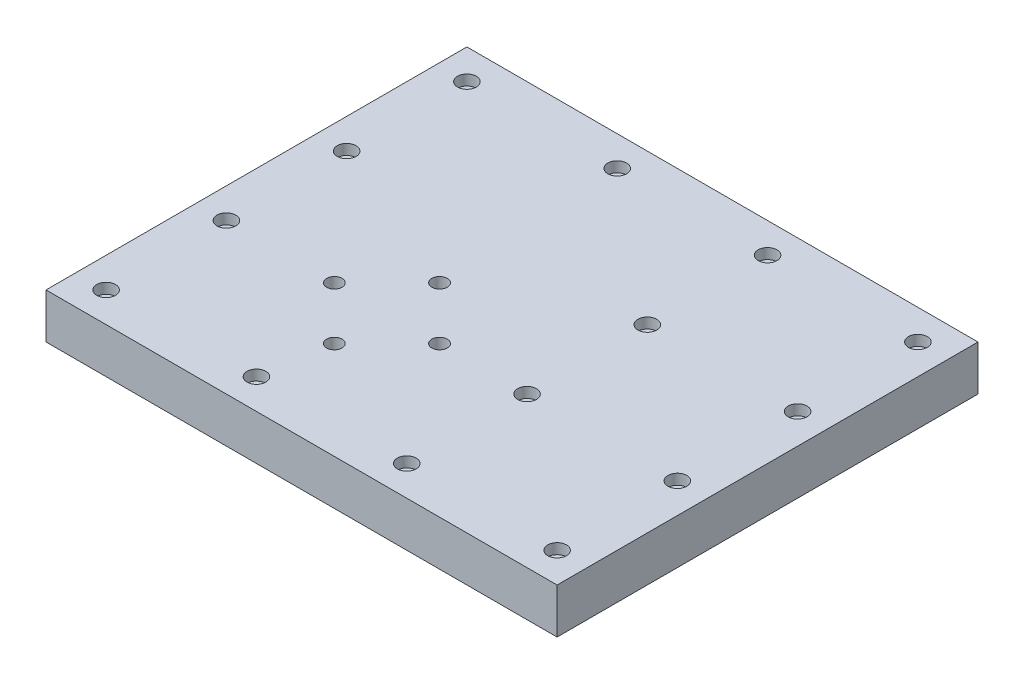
SolidWorks part; units mm, degrees
ref_plane "Front Plane" through (0, 0, 0) normal (0, 0, 1) x (1, 0, 0)
ref_plane "Top Plane" through (0, 0, 0) normal (0, 1, 0) x (1, 0, 0)
ref_plane "Right Plane" through (0, 0, 0) normal (1, 0, 0) x (0, 0, -1)
sketch "Sketch1" plane through (0, 0, 0) normal (0, 1, 0) x (1, 0, 0)
  line L1 (-107.95, 88.9) -> (107.95, 88.9)
  line L2 (-107.95, 88.9) -> (-107.95, -88.9)
  line L3 (-107.95, -88.9) -> (107.95, -88.9)
  line L4 (107.95, 88.9) -> (107.95, -88.9)
  line L5 (-107.95, 88.9) -> (107.95, -88.9) construction
  line L6 (-107.95, -88.9) -> (107.95, 88.9) construction
  point P0 (0, 0)
  dimension "D1" = 177.8
  dimension "D2" = 215.9
extrude "Boss-Extrude1" add sketch "Sketch1" along normal blind 19.05
sketch "Sketch2" plane through (0, 19.05, 0) normal (0, 1, 0) x (1, 0, 0)
  line L0 (-107.95, 88.9) -> (-107.95, -88.9) construction
  line L1 (-107.95, -88.9) -> (107.95, -88.9) construction
  line L2 (-27.432, 8.166) -> (-27.432, -56.3477) construction
  line L3 (-62.1566, -25.4) -> (26.0922, -25.4) construction
  circle A0 centre (-27.432, -25.4) radius 22.225 construction
  circle A2 centre (-27.432, -3.175) radius 3.2639
  circle A3 centre (-49.657, -25.4) radius 3.2639
  circle A4 centre (-27.432, -47.625) radius 3.2639
  circle A5 centre (-5.207, -25.4) radius 3.2639
  dimension "D1" = 44.45
  dimension "D4" = 6.5278
  dimension "D5" = 6.5278
  dimension "D6" = 6.5278
  dimension "D7" = 6.5278
  dimension "D2" = 80.518
  dimension "D3" = 63.5
extrude "Cut-Extrude1" cut sketch "Sketch2" against normal through all and the other way through all
sketch "Sketch3" plane through (0, 19.05, 0) normal (0, 1, 0) x (1, 0, 0)
  line L0 (-107.95, 88.9) -> (-107.95, -88.9) construction
  line L1 (107.95, 88.9) -> (-107.95, 88.9) construction
  circle A0 centre (-95.25, 76.2) radius 3.175 construction
  circle A1 centre (-31.75, 76.2) radius 3.175 construction
  circle A2 centre (31.75, 76.2) radius 3.175 construction
  circle A3 centre (95.25, 76.2) radius 3.175 construction
  circle A4 centre (-31.75, 76.2) radius 3.175 construction
  circle A5 centre (31.75, 76.2) radius 3.175 construction
  circle A6 centre (95.25, 76.2) radius 3.175 construction
  circle A7 centre (-31.75, 25.4) radius 3.175 construction
  circle A8 centre (31.75, 25.4) radius 3.175 construction
  circle A9 centre (95.25, 25.4) radius 3.175 construction
  circle A11 centre (31.75, -25.4) radius 3.175 construction
  circle A12 centre (95.25, -25.4) radius 3.175 construction
  circle A13 centre (-31.75, -76.2) radius 3.175 construction
  circle A14 centre (31.75, -76.2) radius 3.175 construction
  circle A15 centre (95.25, -76.2) radius 3.175 construction
  circle A16 centre (-95.25, 25.4) radius 3.175 construction
  circle A17 centre (-95.25, -25.4) radius 3.175 construction
  circle A18 centre (-95.25, -76.2) radius 3.175 construction
  circle A19 centre (-31.75, -25.4) radius 3.175 construction
  dimension "D1" = 6.35
  dimension "D2" = 12.7
  dimension "D3" = 12.7
  dimension "D5" = 4
  dimension "D4" = 4
  dimension "D6" = 4
hole_wizard "CBORE for #8 Binding Head Machine Screw1" positions "Sketch4" profile "Sketch5" counterbore size "#8" standard "ANSI Inch"
sketch "Sketch4" plane through (0, 19.05, 0) normal (0, 1, 0) x (1, 0, 0)
  point P0 (-95.25, 76.2)
  point P3 (-95.25, 25.4)
  point P6 (-95.25, -25.4)
  point P9 (-95.25, -76.2)
  point P12 (-31.75, -76.2)
  point P18 (-31.75, 76.2)
  point P21 (31.75, 76.2)
  point P24 (95.25, 76.2)
  point P27 (31.75, 25.4)
  point P30 (31.75, -25.4)
  point P33 (31.75, -76.2)
  point P36 (95.25, -76.2)
  point P39 (95.25, 25.4)
  point P42 (95.25, -25.4)
sketch "Sketch5" plane through (-95.25, 19.05, -76.2) normal (1, 0, 0) x (0, 0, 1)
  line L0 (0, 0) -> (0, 19.05)
  line L1 (0, 19.05) -> (2.1527, 19.05)
  line L3 (2.1527, 19.05) -> (2.1526, 4.4196)
  line L4 (2.1526, 4.4196) -> (3.9687, 4.4196)
  line L5 (3.9687, 4.4196) -> (3.9687, 0)
  line L7 (3.9687, 0) -> (0, 0)
  line L11 (0, -6.35) -> (0, 107.95) construction
  dimension "Thru Hole Dia." = 4.3053
  dimension "Thru Hole Depth" = 19.05
  dimension "C'Bore Dia." = 7.9375
  dimension "C'Bore Depth" = 4.4196
